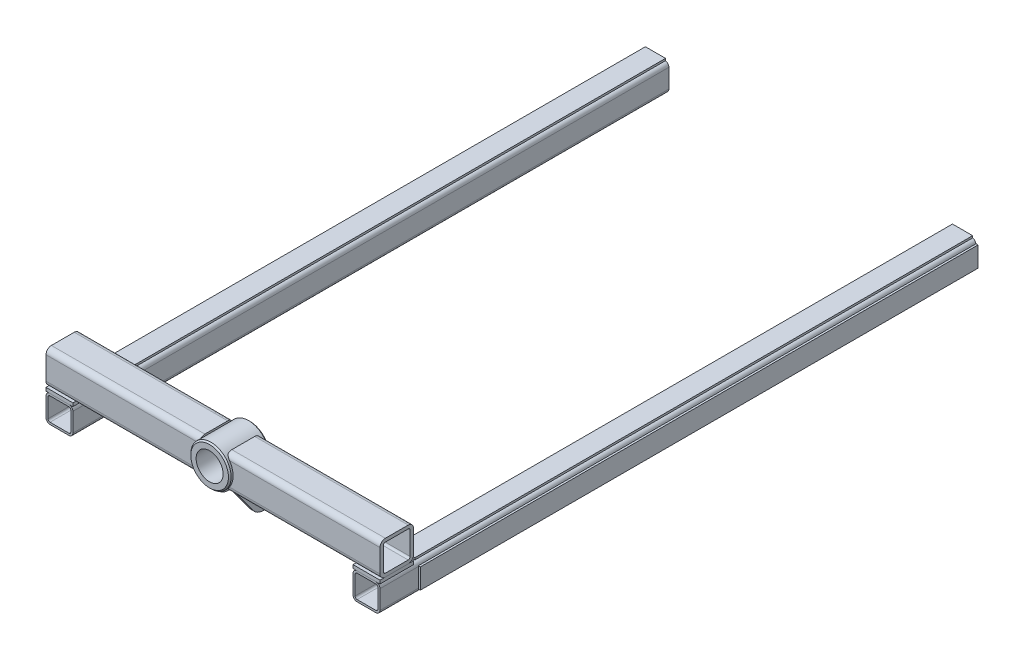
SolidWorks part; units mm, degrees
ref_plane "Plan de face" through (0, 0, 0) normal (0, 0, 1) x (1, 0, 0)
ref_plane "Plan de dessus" through (0, 0, 0) normal (0, 1, 0) x (1, 0, 0)
ref_plane "Plan de droite" through (0, 0, 0) normal (1, 0, 0) x (0, 0, -1)
sketch "Esquisse2" plane through (0, 0, 0) normal (0, 0, 1) x (1, 0, 0)
  circle A0 centre (0, 0) radius 20.1
  circle A1 centre (0, 0) radius 30
  dimension "D1" = 40.2
  dimension "D2" = 60
extrude "Extrusion1" add sketch "Esquisse2" along normal mid plane 60
chamfer "Chanfrein1" distance 2 angle 45 2 edges at (30, 0, -30) (30, 0, 30)
sketch "Esquisse3" plane through (0, 0, 0) normal (0, 0, 1) x (1, 0, 0)
  line L0 (-20.1, 0) -> (-248.5, 0)
  line L1 (20.1, 0) -> (248.5, 0)
  circle A2 centre (0, 0) radius 20.1 construction
  dimension "D1" = 497
other "Elément mécano-soudé1"
ref_plane "Plan1" through (20.1, 0, 0) normal (1, 0, 0) x (0, 0, -1)
sketch "Sketch1" plane through (20.1, 0, 0) normal (1, 0, 0) x (0, 0, -1)
  line L0 (-17, -20) -> (17, -20)
  line L1 (-20, -17) -> (-20, 17)
  line L2 (17, 20) -> (-17, 20)
  line L3 (20, 17) -> (20, -17)
  line L4 (-17, -25) -> (17, -25)
  line L5 (-25, -17) -> (-25, 17)
  line L6 (17, 25) -> (-17, 25)
  line L7 (25, 17) -> (25, -17)
  arc A0 (25, 17) -> (17, 25) centre (17, 17) ccw
  arc A1 (17, -25) -> (25, -17) centre (17, -17) ccw
  arc A2 (-25, -17) -> (-17, -25) centre (-17, -17) ccw
  arc A3 (-17, 25) -> (-25, 17) centre (-17, 17) ccw
  arc A4 (-17, 20) -> (-20, 17) centre (-17, 17) ccw
  arc A5 (20, 17) -> (17, 20) centre (17, 17) ccw
  arc A6 (17, -20) -> (20, -17) centre (17, -17) ccw
  arc A7 (-20, -17) -> (-17, -20) centre (-17, -17) ccw
  point P0 (-25, 0)
  point P1 (25, 0)
  point P2 (0, 25)
  point P3 (0, -25)
  point P4 (0, 0)
  point P5 (-25, -25)
  point P6 (25, -25)
  point P7 (25, 25)
  point P8 (-25, 25)
  point P33 (0, 0)
  dimension "D1" = 8
  dimension "Thickness" = 5
  dimension "V_leg" = 50
sketch "Esquisse5" plane through (0, -25, 0) normal (0, -1, 0) x (1, 0, 0)
  line L0 (-228.5, 25) -> (-228.5, -25)
  line L2 (-20.1, -25) -> (-248.5, -25) construction
  line L3 (228.5, 25) -> (228.5, -25)
  line L4 (248.5, 25) -> (20.1, 25) construction
  line L5 (-20.1, 25) -> (-248.5, 25) construction
  line L6 (-228.5, 0) -> (228.5, 0) construction
  dimension "D1" = 457
other "Elément mécano-soudé2"
ref_plane "Plan2" through (-228.5, -25, 25) normal (0, 0, -1) x (-1, 0, 0)
sketch "Esquisse1" plane through (-208.5, -30, 25) normal (0, 0, -1) x (-1, 0, 0)
  line L0 (20, 5) -> (20, 0) construction
  line L1 (0, 0) -> (40, 0)
  line L2 (0, 0) -> (0, 5)
  line L3 (0, 5) -> (40, 5)
  line L4 (40, 0) -> (40, 5)
  line L5 (40, 2.5) -> (0, 2.5) construction
  point P9 (0, 0)
  dimension "D1" = 40
  dimension "D2" = 5
sketch "Esquisse6" plane through (0, -30, 0) normal (0, -1, 0) x (1, 0, 0)
  line L0 (-228.5, 25) -> (-228.5, -862)
  line L1 (-208.5, 25) -> (-248.5, 25) construction
  line L2 (228.5, 25) -> (228.5, -862)
  line L3 (248.5, 25) -> (208.5, 25) construction
  dimension "D1" = 887
other "Elément mécano-soudé3"
ref_plane "Plan4" through (-228.5, -30, 25) normal (0, 0, -1) x (-1, 0, 0)
sketch "Sketch12" plane through (-228.5, -50, 25) normal (0, 0, -1) x (-1, 0, 0)
  line L0 (-14, -17) -> (14, -17)
  line L1 (-17, -14) -> (-17, 14)
  line L2 (14, 17) -> (-14, 17)
  line L3 (17, 14) -> (17, -14)
  line L4 (-14, -20) -> (14, -20)
  line L5 (-20, -14) -> (-20, 14)
  line L6 (14, 20) -> (-14, 20)
  line L7 (20, 14) -> (20, -14)
  arc A0 (20, 14) -> (14, 20) centre (14, 14) ccw
  arc A1 (14, -20) -> (20, -14) centre (14, -14) ccw
  arc A2 (-20, -14) -> (-14, -20) centre (-14, -14) ccw
  arc A3 (-14, 20) -> (-20, 14) centre (-14, 14) ccw
  arc A4 (-14, 17) -> (-17, 14) centre (-14, 14) ccw
  arc A5 (17, 14) -> (14, 17) centre (14, 14) ccw
  arc A6 (14, -17) -> (17, -14) centre (14, -14) ccw
  arc A7 (-17, -14) -> (-14, -17) centre (-14, -14) ccw
  point P0 (-20, 0)
  point P1 (20, 0)
  point P2 (0, 20)
  point P3 (0, -20)
  point P4 (0, 0)
  point P5 (-20, -20)
  point P6 (20, -20)
  point P7 (20, 20)
  point P8 (-20, 20)
  point P33 (0, 0)
  dimension "D1" = 6
  dimension "Thickness" = 3
  dimension "V_leg" = 40
sketch "Esquisse9" plane through (-248.5, 0, 0) normal (-1, 0, 0) x (0, 0, 1)
  line L0 (-862, -50) -> (-32, -50)
  line L1 (-862, -64) -> (-862, -36) construction
  dimension "D1" = 830
other "Elément mécano-soudé4"
ref_plane "Plan5" through (-248.5, -50, -862) normal (0, 0, 1) x (1, 0, 0)
sketch "Esquisse11" plane through (-250, -50, -862) normal (0, 0, 1) x (0, -1, 0)
  line L0 (0, 1.5) -> (0, -1.5) construction
  line L1 (-15, 1.5) -> (15, 1.5)
  line L2 (-15, 1.5) -> (-15, -1.5)
  line L3 (-15, -1.5) -> (15, -1.5)
  line L4 (15, 1.5) -> (15, -1.5)
  line L5 (15, 0) -> (-15, 0) construction
  point P8 (0, 0)
  dimension "D1" = 30
  dimension "D2" = 3
sketch "Esquisse12" plane through (0, -30, 0) normal (0, 1, 0) x (-1, 0, 0)
  line L0 (228.5, -862) -> (228.5, -32)
  dimension "D1" = 830
other "Elément mécano-soudé5"
ref_plane "Plan6" through (-228.5, -30, -862) normal (0, 0, 1) x (1, 0, 0)
sketch "Esquisse13" plane through (-228.5, -28.5, -862) normal (0, 0, 1) x (1, 0, 0)
  line L0 (0, 1.5) -> (0, -1.5) construction
  line L1 (-15, 1.5) -> (15, 1.5)
  line L2 (-15, 1.5) -> (-15, -1.5)
  line L3 (-15, -1.5) -> (15, -1.5)
  line L4 (15, 1.5) -> (15, -1.5)
  line L5 (15, 0) -> (-15, 0) construction
  point P8 (0, 0)
  dimension "D1" = 30
  dimension "D2" = 3
mirror "Symétrie1" about plane through (0, 0, 0) normal (1, 0, 0)
inserted part "laser chape du télescope"
move or copy body "Corps-Déplacer/Copier2" placed by mates yes
other "Distance1" parameters "D1"=23
other "<laser chape du télescope>-<Extrusion1>"
inserted part "laser chape du télescope1"
move or copy body "Corps-Déplacer/Copier4" placed by mates yes
other "Distance2" parameters "D1"=23
other "<laser chape du télescope>-<Extrusion1>"
